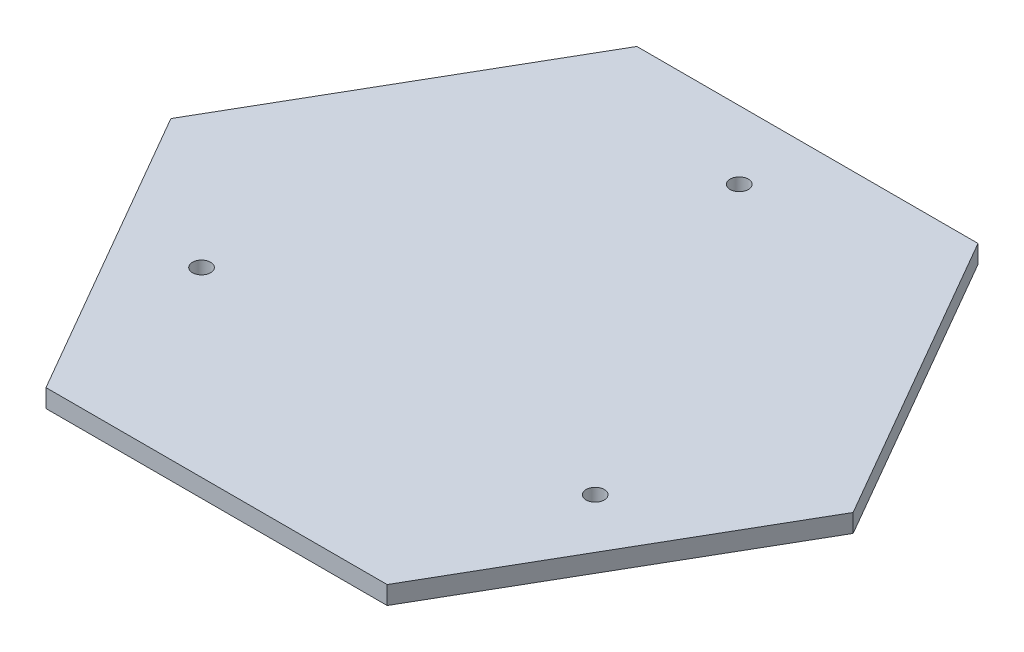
SolidWorks part; units mm, degrees
ref_plane "Front Plane" through (0, 0, 0) normal (0, 0, 1) x (1, 0, 0)
ref_plane "Top Plane" through (0, 0, 0) normal (0, 1, 0) x (1, 0, 0)
ref_plane "Right Plane" through (0, 0, 0) normal (1, 0, 0) x (0, 0, -1)
sketch "Sketch1" plane through (0, 0, 0) normal (0, 1, 0) x (1, 0, 0)
  line L0 (0, 32.5) -> (0, -32.5) construction
  line L1 (37.5278, 0) -> (18.7639, 32.5)
  line L2 (18.7639, 32.5) -> (-18.7639, 32.5)
  line L3 (-18.7639, 32.5) -> (-37.5278, 0)
  line L4 (-37.5278, 0) -> (-18.7639, -32.5)
  line L5 (-18.7639, -32.5) -> (18.7639, -32.5)
  line L6 (18.7639, -32.5) -> (37.5278, 0)
  line L7 (-28.1458, 16.25) -> (28.1458, -16.25) construction
  line L8 (28.1458, 16.25) -> (-28.1458, -16.25) construction
  circle A0 centre (0, 0) radius 32.5 construction
extrude "Boss-Extrude1" add sketch "Sketch1" along normal blind 2
sketch "Sketch2" plane through (0, 2, 0) normal (0, 1, 0) x (1, 0, 0)
  line L0 (0, 32.5) -> (0, -32.5)
  line L1 (-28.1458, 16.25) -> (28.1458, -16.25)
  line L2 (28.1458, 16.25) -> (-28.1458, -16.25)
ref_plane "Plane1" through (0, 0, 0) normal (-0.5, 0, -0.866) x (-0.866, 0, 0.5)
ref_plane "Plane2" through (0, 0, 0) normal (-0.5, 0, 0.866) x (0.866, 0, 0.5)
ref_plane "Plane3" through (0, 0, 0) normal (-1, 0, 0) x (0, 0, 1)
sketch "Sketch3" plane through (0, 0, 0) normal (0, 1, 0) x (1, 0, 0)
  line L0 (0, 32.5) -> (0, -32.5) construction
  line L7 (0, 32.5) -> (-28.1458, -16.25) construction
  line L8 (-28.1458, -16.25) -> (28.1458, -16.25) construction
  line L9 (28.1458, -16.25) -> (0, 32.5) construction
  line L10 (0, 25) -> (-21.6506, -12.5) construction
  line L11 (-21.6506, -12.5) -> (21.6506, -12.5) construction
  line L12 (21.6506, -12.5) -> (0, 25) construction
  circle A0 centre (0, 25) radius 1
  circle A1 centre (21.6506, -12.5) radius 1
  circle A2 centre (-21.6506, -12.5) radius 1
  point P0 (0, 25)
  dimension "D1" = 2
  dimension "D2" = 7.5
extrude "Cut-Extrude1" cut sketch "Sketch3" along normal blind 21
equation "\"thkness\"= 2mm"
equation "\"size\"= 65mm"
equation "\"side_len\"= \"size\" / (2 * sin ( 60 ) )"
equation "\"D1@Boss-Extrude1\"=\"thkness\""
equation "\"D1@Sketch1\"=\"size\""
